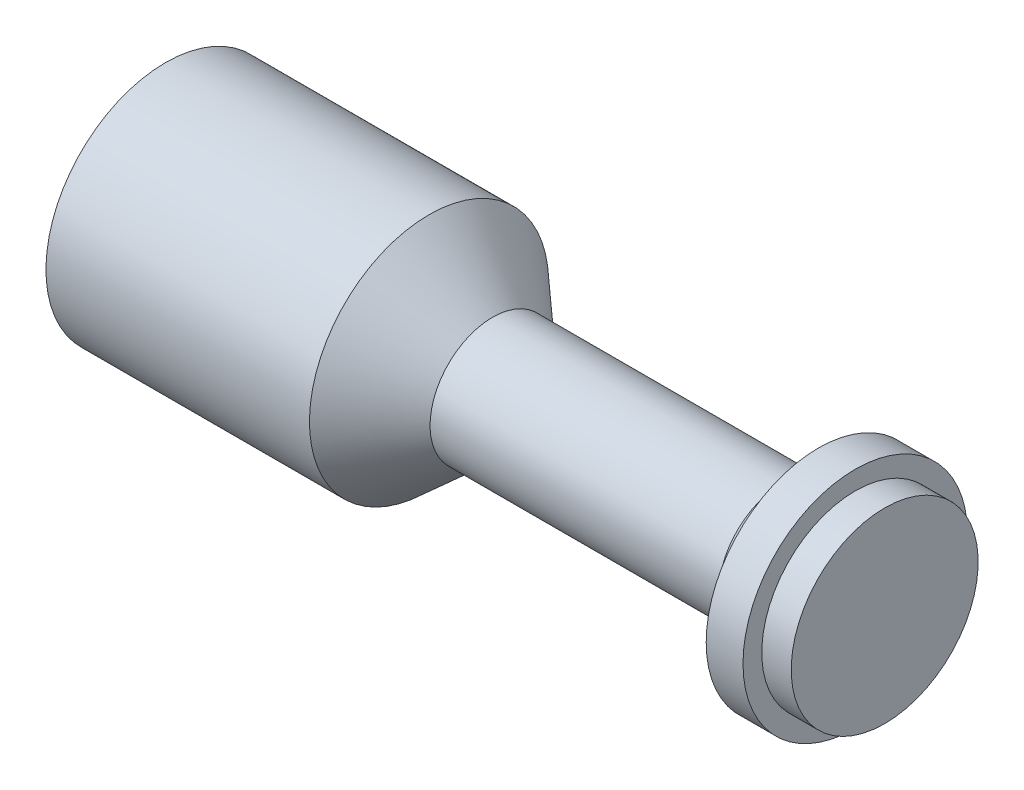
SolidWorks part; units mm, degrees
ref_plane "Front Plane" through (0, 0, 0) normal (0, 0, 1) x (1, 0, 0)
ref_plane "Top Plane" through (0, 0, 0) normal (0, 1, 0) x (1, 0, 0)
ref_plane "Right Plane" through (0, 0, 0) normal (1, 0, 0) x (0, 0, -1)
sketch "Sketch1" plane through (0, 0, 0) normal (0, 0, 1) x (1, 0, 0)
  line L0 (-60.0157, 0) -> (-60.0157, 16.25)
  line L1 (-60.0157, 16.25) -> (-24.2157, 16.25)
  line L2 (-24.2157, 16.25) -> (-15.5828, 8.5)
  line L3 (-15.5828, 8.5) -> (-8.2157, 8.5)
  line L4 (-8.2157, 8.5) -> (-3.7339, 8.5)
  line L5 (-3.7339, 8.5) -> (0, 8.5)
  line L6 (0, 8.5) -> (23.6491, 8.5)
  line L7 (23.6491, 8.5) -> (26.0597, 10.9105)
  line L8 (26.0597, 10.9105) -> (28.6843, 10.9105)
  line L9 (28.6843, 10.9105) -> (28.6843, 15.25)
  line L10 (28.6843, 15.25) -> (33.6843, 15.25)
  line L11 (33.6843, 15.25) -> (33.6843, 12.7)
  line L12 (33.6843, 12.7) -> (37.6843, 12.7)
  line L13 (37.6843, 12.7) -> (37.6843, 0)
  line L14 (37.6843, 0) -> (-60.0157, 0)
  point P2 (-11.8992, 8.5)
  dimension "D1" = 16.25
  dimension "D2" = 35.8
  dimension "D3" = 16
  dimension "D4" = 8.5
  dimension "D5" = 36.9
  dimension "D6" = 15.25
  dimension "D7" = 12.7
  dimension "D8" = 4
  dimension "D9" = 5
revolve "Revolve1" add sketch "Sketch1" angle 360 about L14
